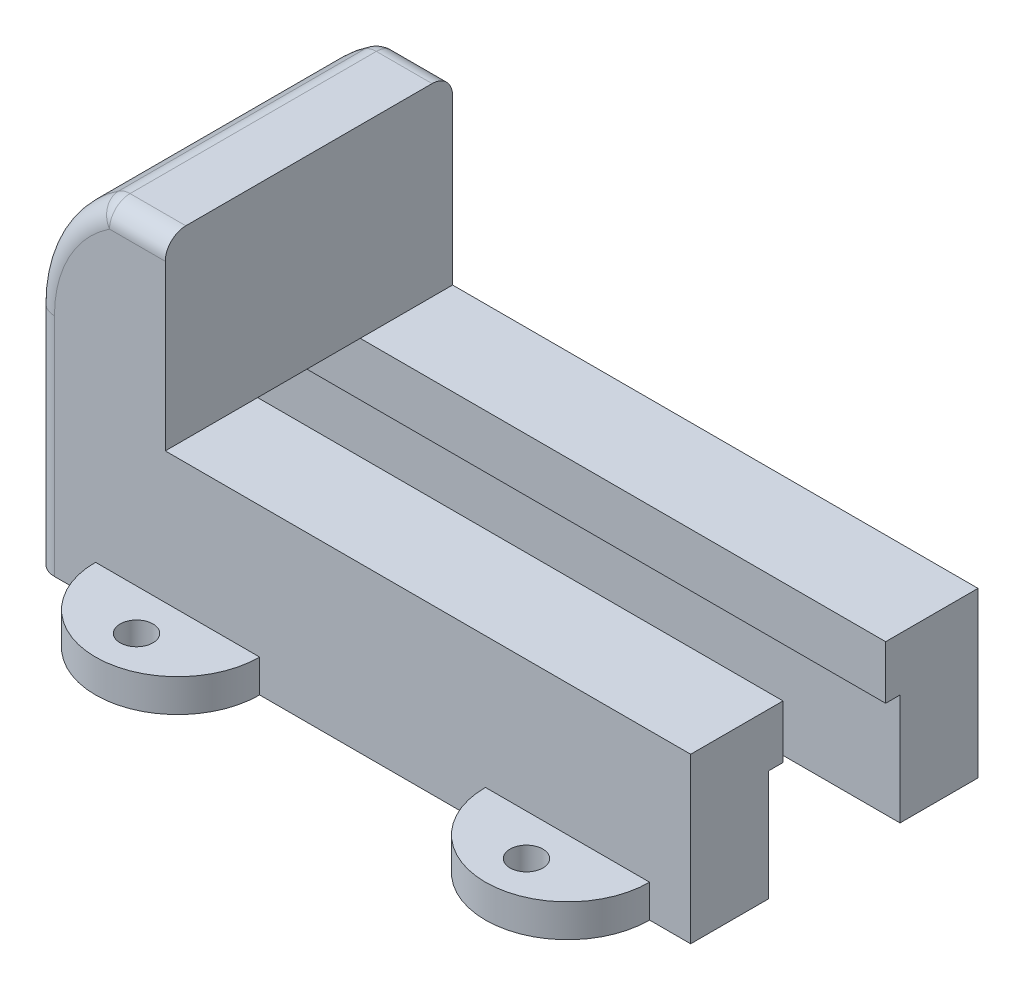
SolidWorks part; units mm, degrees
ref_plane "Front Plane" through (0, 0, 0) normal (0, 0, 1) x (1, 0, 0)
ref_plane "Top Plane" through (0, 0, 0) normal (0, 1, 0) x (1, 0, 0)
ref_plane "Right Plane" through (0, 0, 0) normal (1, 0, 0) x (0, 0, -1)
sketch "Sketch1" plane through (0, 0, 0) normal (0, 0, 1) x (1, 0, 0)
  line L1 (0, 0) -> (185, 0)
  line L2 (0, 0) -> (0, 40)
  line L3 (0, 40) -> (185, 40)
  line L4 (185, 0) -> (185, 40)
  dimension "D1" = 40
  dimension "D2" = 185
extrude "Extrude1" add sketch "Sketch1" along normal mid plane 70
sketch "Sketch2" plane through (0, 0, 35) normal (0, 0, 1) x (1, 0, 0)
  line L1 (0, 40) -> (32, 40)
  line L2 (0, 40) -> (0, 55)
  line L3 (16.9722, 85) -> (32, 85)
  line L4 (32, 40) -> (32, 85)
  arc A0 (0, 55) -> (16.9722, 85) centre (35, 55) cw
  dimension "D2" = 35
  dimension "D1" = 32
  dimension "D3" = 45
  dimension "D4" = 30
extrude "Extrude2" add sketch "Sketch2" against normal up to vertex (70 mm away)
sketch "Sketch3" plane through (185, 0, 0) normal (1, 0, 0) x (0, 0, -1)
  line L0 (-35, 0) -> (-35, 40) construction
  line L1 (-35, 40) -> (35, 40)
  line L2 (-35, 40) -> (-35, 55)
  line L3 (-35, 55) -> (-17, 55)
  line L4 (35, 40) -> (35, 55)
  line L5 (-35, 40) -> (35, 40) construction
  line L6 (-35, 0) -> (35, 0) construction
  line L7 (17, 55) -> (35, 55)
  line L8 (0, 50) -> (0, -50) construction
  arc A0 (17, 55) -> (-17, 55) centre (0, 55) ccw
  dimension "D2" = 17
  dimension "D1" = 55
extrude "Extrude3" add sketch "Sketch3" against normal blind 25
sketch "Sketch4" plane through (185, 0, 0) normal (1, 0, 0) x (0, 0, -1)
  line L0 (-35, 0) -> (35, 0) construction
  line L1 (-16, 0) -> (16, 0)
  line L2 (-12.5, 27) -> (-12.5, 40)
  line L3 (-12.5, 40) -> (12.5, 40)
  line L4 (12.5, 27) -> (12.5, 40)
  line L5 (-16, 0) -> (-16, 27)
  line L6 (-16, 27) -> (-12.5, 27)
  line L7 (16, 27) -> (16, 0)
  line L8 (0, 0) -> (0, 40) construction
  line L9 (12.5, 27) -> (16, 27)
  dimension "D1" = 40
  dimension "D2" = 25
  dimension "D3" = 32
  dimension "D4" = 27
extrude "Cut-Extrude1" cut sketch "Sketch4" against normal through all
sketch "Sketch5" plane through (0, 0, 0) normal (0, -1, 0) x (1, 0, 0)
  line L0 (0, 35) -> (185, 35) construction
  line L1 (15, 35) -> (55, 35)
  arc A0 (15, 35) -> (55, 35) centre (35, 35) cw
  dimension "D1" = 20
  dimension "D2" = 35
extrude "Extrude4" add sketch "Sketch5" against normal blind 8
sketch "Sketch6" plane through (0, 0, 0) normal (0, -1, 0) x (1, 0, 0)
  line L0 (55, 35) -> (185, 35) construction
  line L1 (110, 35) -> (150, 35)
  line L3 (185, 35) -> (185, 16) construction
  arc A0 (110, 35) -> (150, 35) centre (130, 35) cw
  dimension "D1" = 20
  dimension "D2" = 55
extrude "Extrude5" add sketch "Sketch6" against normal up to surface (8 mm away)
mirror "Mirror1" about plane through (0, 0, 0) normal (0, 0, 1) of "Extrude5", "Extrude4"
hole_wizard "Ø8.0 (8) Diameter Hole1" positions "Sketch11" profile "Sketch10" hole size "Ø8.0" standard "Ansi Metric"
sketch "Sketch11" plane through (0, 8, 0) normal (0, 1, 0) x (-1, 0, 0)
  line L0 (0, 0) -> (-84.8783, 0) construction
  line L2 (-35, 45) -> (-35, 35) construction
  line L3 (-130, 45) -> (-130, 35) construction
  line L11 (-15, 35) -> (-55, 35) construction
  point P0 (-35, 45)
  point P1 (-130, 45)
  point P35 (-35, -45)
  point P36 (-130, -45)
  dimension "D1" = 10
sketch "Sketch10" plane through (35, 8, 45) normal (1, 0, 0) x (0, 0, 1)
  line L0 (0, 0) -> (0, 8)
  line L1 (0, 8) -> (4, 8)
  line L2 (4, 8) -> (4, 0)
  line L5 (4, 0) -> (0, 0)
  line L11 (0, -6.35) -> (0, 107.95) construction
  dimension "Thru Hole Dia." = 8
  dimension "Thru Hole Depth" = 8
hole_wizard "Ø14.0 (14) Diameter Hole1" positions "Sketch8" profile "Sketch9" hole size "Ø14.0" standard "Ansi Metric"
sketch "Sketch8" plane through (185, 0, 0) normal (1, 0, 0) x (0, 0, -1)
  point P0 (0, 55)
sketch "Sketch9" plane through (185, 55, 0) normal (0, 1, 0) x (0, 0, -1)
  line L0 (0, 0) -> (0, 25)
  line L1 (0, 25) -> (7, 25)
  line L2 (7, 25) -> (7, 0)
  line L5 (7, 0) -> (0, 0)
  line L11 (0, -6.35) -> (0, 107.95) construction
  dimension "Thru Hole Dia." = 14
  dimension "Thru Hole Depth" = 25
fillet "Fillet3" radius 2 1 edges at (185, 55, 26)
fillet "Fillet10" radius 5 7 edges at (4.5371, 72.2341, 35) (4.5371, 72.2341, -35) (0, 27.5, 35) (0, 27.5, -35) (24.4861, 85, 35) (24.4861, 85, -35) (16.9722, 85, 0)
sketch "Sketch12" plane through (0, 0, 35) normal (0, 0, 1) x (1, 0, 0)
  line L0 (160, 86.7771) -> (160, -16.6768)
extrude "Cut-Extrude2" cut sketch "Sketch12" against normal through all and the other way through all
